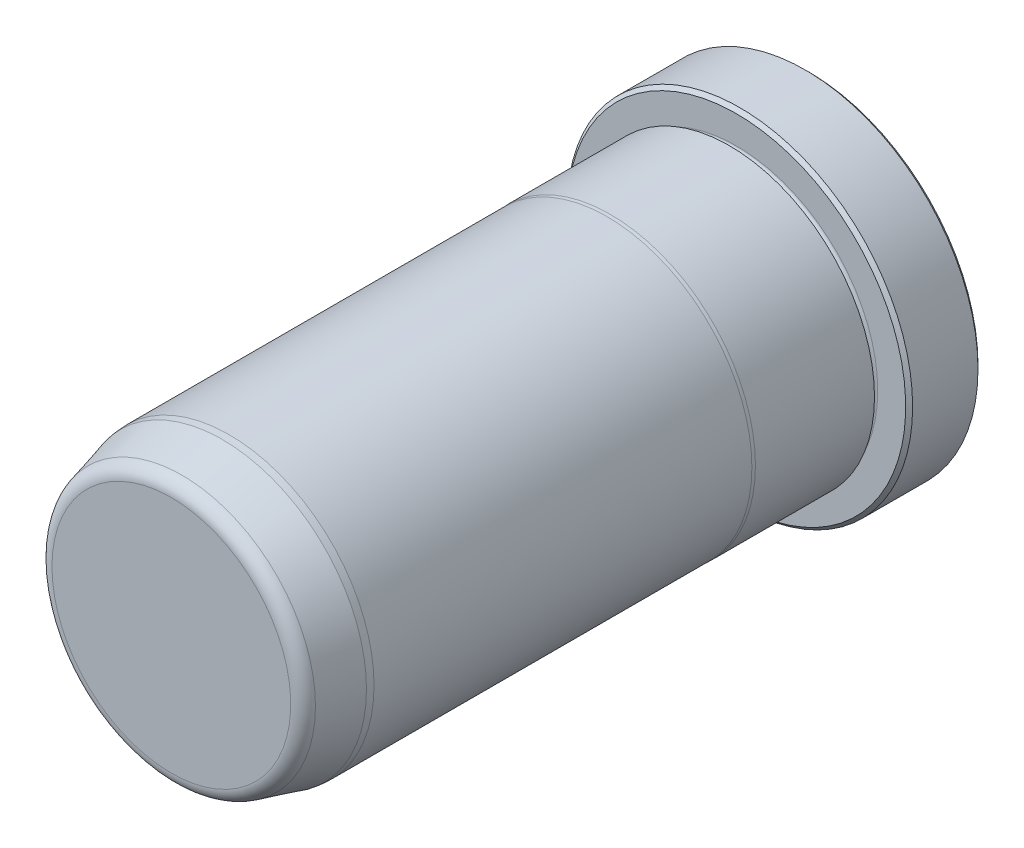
SolidWorks part; units mm, degrees
ref_plane "Front Plane" through (0, 0, 0) normal (0, 0, 1) x (1, 0, 0)
ref_plane "Top Plane" through (0, 0, 0) normal (0, 1, 0) x (1, 0, 0)
ref_plane "Right Plane" through (0, 0, 0) normal (1, 0, 0) x (0, 0, -1)
sketch "Sketch1" plane through (0, 0, 0) normal (1, 0, 0) x (0, 0, -1)
  line L0 (0, 0) -> (0, 18.923)
  line L1 (0, 18.923) -> (-7.9248, 18.923)
  line L2 (-7.9248, 18.923) -> (-7.9248, 15.4813)
  line L3 (-4.7498, 15.1003) -> (-5.5118, 15.1003) construction
  line L4 (-8.6868, 15.4813) -> (-8.6868, 15.8877)
  line L5 (-8.6868, 15.8877) -> (-21.7348, 15.8877)
  line L6 (-21.7348, 15.8877) -> (-22.098, 15.8623)
  line L7 (-22.098, 15.8623) -> (-63.5, 15.8623)
  line L9 (-69.85, 14.2983) -> (-69.85, 0)
  line L10 (-69.85, 0) -> (0, 0)
  line L11 (0, 0) -> (13.6287, 0) construction
  line L12 (-63.5, 15.8623) -> (-64.262, 15.7956)
  line L13 (-64.262, 15.7956) -> (-69.85, 14.2983)
  arc A0 (-8.6868, 15.4813) -> (-7.9248, 15.4813) centre (-8.3058, 15.4813) ccw
  dimension "D14" = 0.762
  dimension "D1" = 7.9248
  dimension "D2" = 0.762
  dimension "D3" = 37.846
  dimension "D4" = 31.7754
  dimension "D5" = 22.098
  dimension "D6" = 69.85
  dimension "D7" = 0.7874
  dimension "D8" = 4
  dimension "D9" = 31.7246
  dimension "D10" = 5
  dimension "D11" = 15
  dimension "D12" = 0.762
  dimension "D13" = 6.35
revolve "Revolve1" add sketch "Sketch1" angle 360 about L11
fillet "Fillet6" radius 1.5875 1 edges at (14.2983, 0, 69.85)
chamfer "Chamfer1" distance 0.381 angle 45 2 edges at (18.923, 0, 0) (18.923, 0, 7.9248)
